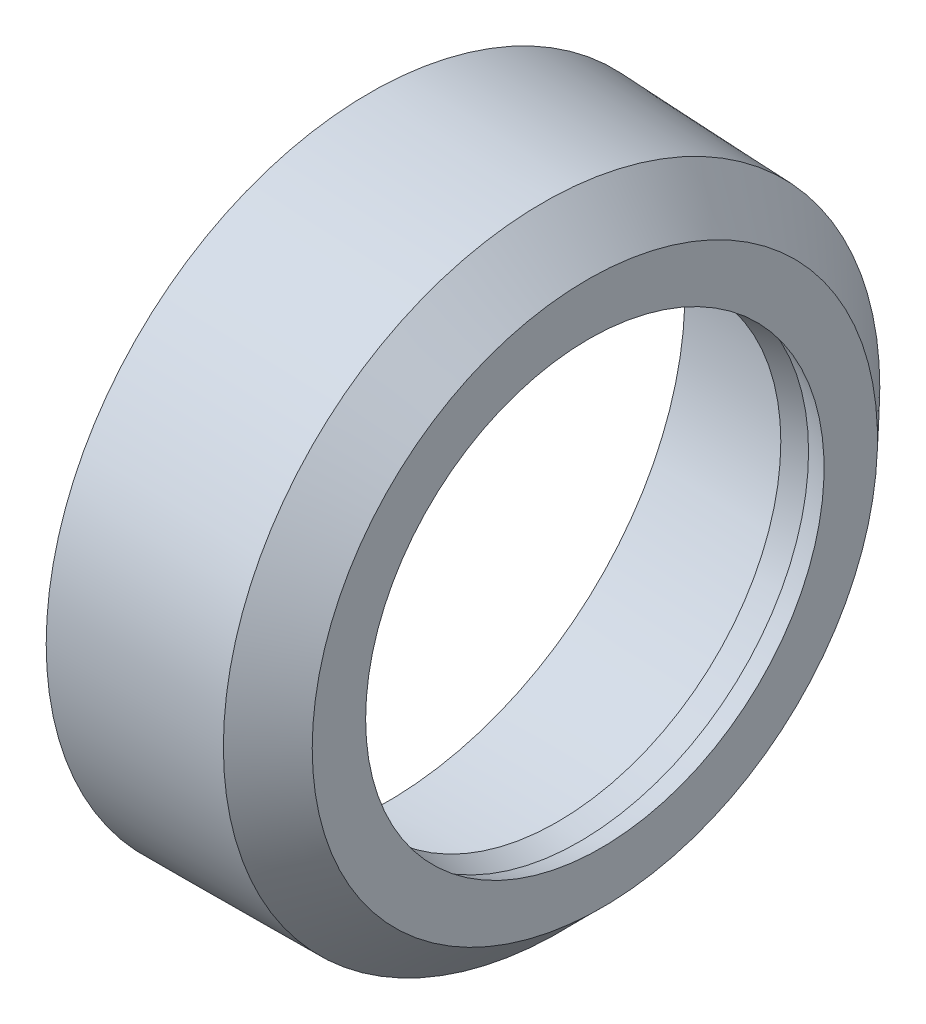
SolidWorks part; units mm, degrees
ref_plane "Plan1" through (0, 0, 0) normal (0, 0, 1) x (1, 0, 0)
ref_plane "Plan2" through (0, 0, 0) normal (0, 1, 0) x (1, 0, 0)
ref_plane "Plan3" through (0, 0, 0) normal (1, 0, 0) x (0, 0, -1)
sketch "Esquisse2" plane through (0.9744, 0, -37.2117) normal (-0.0262, 0, 0.9997) x (0.9997, 0, 0.0262)
  line L0 (63.0252, -8.2318) -> (77.0252, -8.55)
  line L3 (63.0252, -6.2313) -> (77.0252, -6.5495)
  line L4 (80.5252, -10.0495) -> (80.5252, -14.15)
  line L5 (77.0252, -14.15) -> (78.7752, -13.6811)
  line L6 (77.0252, -53.9725) -> (77.0252, -9.5275) construction
  line L7 (77.0252, -14.15) -> (77.0252, -8.55)
  line L8 (74.7284, -31.75) -> (48.0764, -31.75) construction
  line L9 (30.0752, -31.75) -> (28.0752, -31.75) construction
  line L10 (78.7752, -13.6811) -> (80.5252, -14.15)
  line L11 (80.5252, -10.0495) -> (77.0252, -6.5495)
  line L12 (63.0252, -6.2313) -> (63.0252, -8.2318)
  line L13 (77.0252, -14.15) -> (41.0252, -14.15) construction
  line L15 (41.0252, -48.6248) -> (41.0252, -14.15) construction
  line L16 (76.048, -8.5278) -> (36.9344, -7.6388) construction
  line L17 (76.5253, -13.5303) -> (41.0252, -14.15) construction
  dimension "D1" = 2
  dimension "D2" = 14
  dimension "D3" = 45
  dimension "D4" = 15
  dimension "D5" = 3.5
revolve "Base-Révolution" add sketch "Esquisse2" angle 360 about L8
